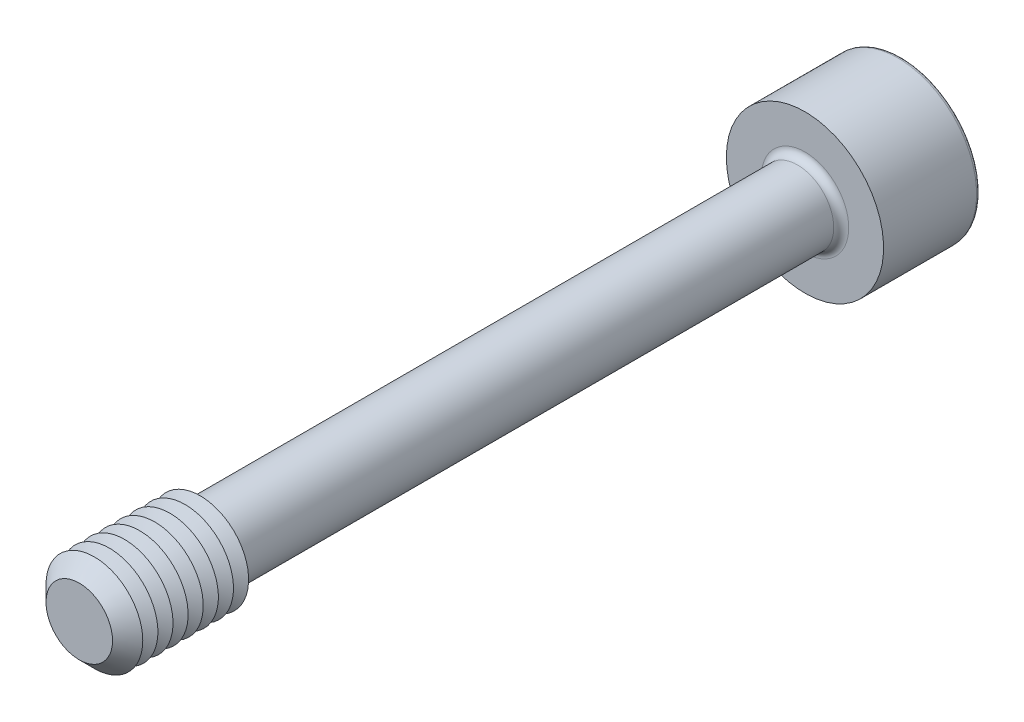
SolidWorks part; units mm, degrees
ref_plane "Front Plane" through (0, 0, 0) normal (0, 0, 1) x (1, 0, 0)
ref_plane "Top Plane" through (0, 0, 0) normal (0, 1, 0) x (1, 0, 0)
ref_plane "Right Plane" through (0, 0, 0) normal (1, 0, 0) x (0, 0, -1)
sketch "Sketch1" plane through (0, 0, 0) normal (0, 0, 1) x (1, 0, 0)
  circle A0 centre (0, 0) radius 3
  dimension "D1" = 6
extrude "Extrude1" add sketch "Sketch1" along normal mid plane 60
sketch "Sketch2" plane through (0, 0, 0) normal (1, 0, 0) x (0, 0, -1)
  line L0 (-30, 0) -> (-30, 4)
  line L1 (-30, 3) -> (-30, -3) construction
  line L2 (-30, 4) -> (-20, 4)
  line L3 (-20, 4) -> (-19.4226, 3)
  line L4 (30, 3) -> (-30, 3) construction
  line L5 (-19.4226, 3) -> (-19.4226, 0)
  line L6 (-19.4226, 0) -> (-30, 0)
  dimension "D1" = 4
  dimension "D2" = 120
  dimension "D3" = 10
revolve "Revolve1" add sketch "Sketch2" angle 360 about L6
chamfer "Chamfer1" distance 1.25 angle 45 1 edges at (0, 4, 30)
sketch "Sketch3" plane through (0, 0, -30) normal (0, 0, -1) x (-1, 0, 0)
  circle A0 centre (0, 0) radius 6.5
  dimension "D1" = 13
extrude "Extrude2" add sketch "Sketch3" along normal blind 8
sketch "Sketch4" plane through (-13.7, 0, -38) normal (0, 0, 1) x (1, 0, 0)
  line L2 (11.9679, -3) -> (15.4321, -3)
  line L3 (15.4321, -3) -> (17.1641, 0)
  line L4 (17.1641, 0) -> (15.4321, 3)
  line L6 (15.4321, 3) -> (11.9679, 3)
  line L7 (11.9679, 3) -> (10.2359, 0)
  line L8 (10.2359, 0) -> (11.9679, -3)
  circle A0 centre (13.7, 0) radius 3 construction
  dimension "D1" = 6
extrude "Extrude3" cut sketch "Sketch4" along normal blind 6
fillet "Fillet1" radius 0.62 1 edges at (-3, 0, -30)
fillet "Fillet2" radius 0.31 1 edges at (-6.5, 0, -38)
sketch "Sketch5" plane through (0, 0, 0) normal (1, 0, 0) x (0, 0, -1)
  line L0 (32, 0) -> (32, -3)
  line L1 (32, -3) -> (30.2679, 0)
  line L2 (30.2679, 0) -> (32, 0)
  dimension "D1" = 30
revolve "Cut-Revolve1" cut sketch "Sketch5" angle 360 about L2
sketch "Sketch6" plane through (0, 0, 0) normal (1, 0, 0) x (0, 0, -1)
  line L0 (1.332, 0) -> (-13.289, 0) construction
sketch "Sketch7" plane through (0, 0, 0) normal (1, 0, 0) x (0, 0, -1)
  line L0 (-20, 4) -> (-20.625, 2.9175)
  line L1 (-20.625, 2.9175) -> (-21.25, 4)
  line L2 (-20, 4) -> (-28.75, 4) construction
  line L3 (-21.25, 4) -> (-20, 4)
  dimension "D1" = 1.25
revolve "Cut-Revolve2" cut sketch "Sketch7" angle 360 about L0
pattern_linear "LPattern1" count 7 spacing 1.25 along (0, 0, 1) of "Cut-Revolve2"
